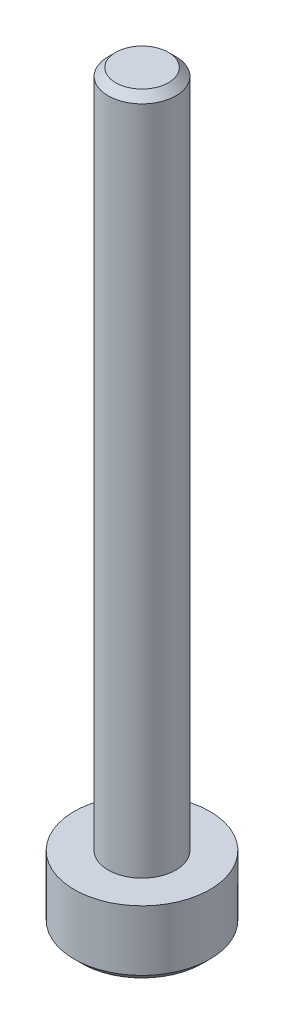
SolidWorks part; units mm, degrees
ref_plane "Front Plane" through (0, 0, 0) normal (0, 0, 1) x (1, 0, 0)
ref_plane "Top Plane" through (0, 0, 0) normal (0, 1, 0) x (1, 0, 0)
ref_plane "Right Plane" through (0, 0, 0) normal (1, 0, 0) x (0, 0, -1)
sketch "Sketch1" plane through (0, 0, 0) normal (0, 1, 0) x (1, 0, 0)
  circle A0 centre (0, 0) radius 1.5
  dimension "D1" = 3
extrude "Boss-Extrude1" add sketch "Sketch1" along normal blind 30
sketch "Sketch2" plane through (0, 0, 0) normal (0, -1, 0) x (1, 0, 0)
  circle A0 centre (0, 0) radius 3
  circle A1 centre (0, 0) radius 1.5 construction
extrude "Boss-Extrude2" add sketch "Sketch2" along normal blind 3 contours A0
sketch "Sketch3" plane through (0, -3, 0) normal (0, -1, 0) x (1, 0, 0)
  line L1 (0, 1.7321) -> (-1.5, 0.866)
  line L2 (-1.5, 0.866) -> (-1.5, -0.866)
  line L3 (-1.5, -0.866) -> (0, -1.7321)
  line L4 (0, -1.7321) -> (1.5, -0.866)
  line L5 (1.5, -0.866) -> (1.5, 0.866)
  line L6 (1.5, 0.866) -> (0, 1.7321)
  circle A0 centre (0, 0) radius 1.5 construction
extrude "Cut-Extrude1" cut sketch "Sketch3" against normal blind 2
chamfer "Chamfer1" distance 0.3333 angle 45 2 edges at (0, 30, 1.5) (0, -3, -3)
equation "\"Length\"= 30"
equation "\"Dia\"= 3"
equation "\"D1@Sketch2\"=\"Dia\"/2"
equation "\"D1@Boss-Extrude2\"=\"Dia\""
equation "\"D1@Sketch3\"=\"Dia\""
equation "\"D1@Cut-Extrude1\"=\"Dia\"/1.5"
equation "\"D1@Chamfer1\"=\"Dia\"/(\"Dia\"*3)"
equation "\"D1@Boss-Extrude1\"=\"Length\""
